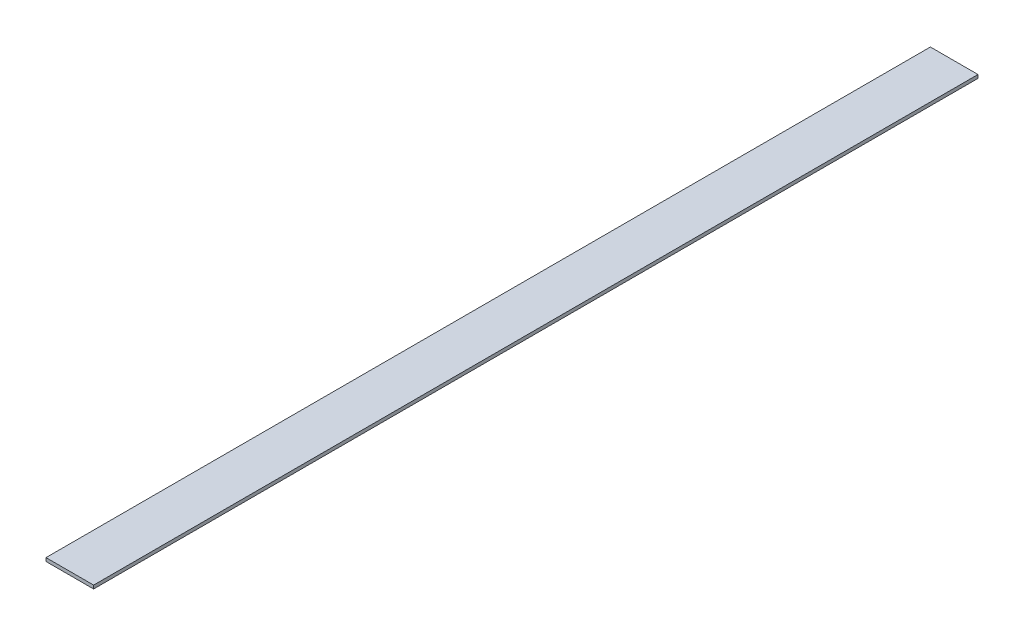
SolidWorks part; units mm, degrees
ref_plane "Face" through (0, 0, 0) normal (0, 0, 1) x (1, 0, 0)
ref_plane "Dessus" through (0, 0, 0) normal (0, 1, 0) x (1, 0, 0)
ref_plane "Droite" through (0, 0, 0) normal (1, 0, 0) x (0, 0, -1)
sketch "Esquisse1" plane through (0, 0, 0) normal (0, 0, 1) x (1, 0, 0)
  line L1 (0, 0) -> (70, 0)
  line L2 (0, 0) -> (0, -5)
  line L3 (0, -5) -> (70, -5)
  line L4 (70, 0) -> (70, -5)
  dimension "D1" = 70
  dimension "D2" = 5
extrude "Base-Extrusion" add sketch "Esquisse1" against normal blind 1300
